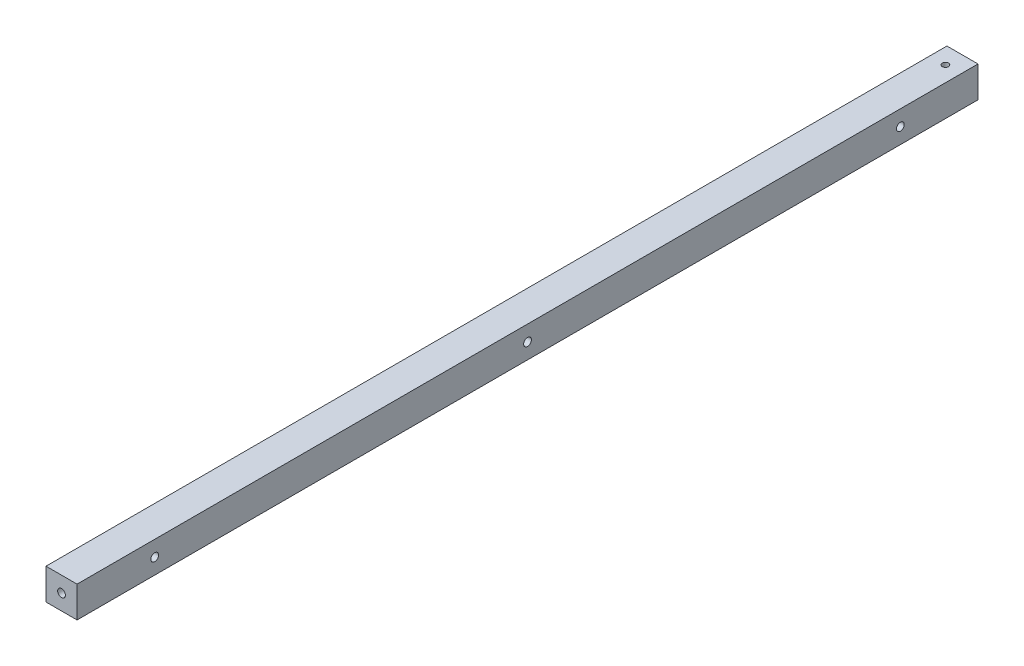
SolidWorks part; units mm, degrees
ref_plane "Plan de face" through (0, 0, 0) normal (0, 0, 1) x (1, 0, 0)
ref_plane "Plan de dessus" through (0, 0, 0) normal (0, 1, 0) x (1, 0, 0)
ref_plane "Plan de droite" through (0, 0, 0) normal (1, 0, 0) x (0, 0, -1)
sketch "Esquisse1" plane through (0, 0, 0) normal (0, 0, 1) x (1, 0, 0)
  line L1 (-10, 10) -> (10, 10)
  line L2 (-10, 10) -> (-10, -10)
  line L3 (-10, -10) -> (10, -10)
  line L4 (10, 10) -> (10, -10)
  dimension "D1" = 20
  dimension "D2" = 20
  dimension "D3" = 10
  dimension "D4" = 10
extrude "Extrusion1" add sketch "Esquisse1" along normal blind 580
hole_wizard "Diamètre du perçage M12.5 (12.500000)1" positions "Esquisse3" profile "Esquisse2" hole size "M12.5" standard "ISO"
sketch "Esquisse3" plane through (0, 0, 0) normal (0, 0, -1) x (-1, 0, 0)
  point P0 (0, 0)
sketch "Esquisse2" plane through (0, 0, 0) normal (1, 0, 0) x (0, 1, 0)
  line L0 (0, 0) -> (0, 23.7554)
  line L1 (0, 23.7554) -> (6.25, 20)
  line L2 (6.25, 20) -> (6.25, 0)
  line L5 (6.25, 0) -> (0, 0)
  line L10 (0, 23.7554) -> (-6.25, 20) construction
  line L11 (0, -6.35) -> (0, 107.95) construction
  dimension "Diamètre du perçage" = 12.5
  dimension "Profondeur du perçage" = 20
  dimension "Angle de pointe" = 118
hole_wizard "Diamètre du perçage M4.0 (4.000000)1" positions "Esquisse5" profile "Esquisse4" hole size "M4.0" standard "ISO"
sketch "Esquisse5" plane through (0, -10, 0) normal (0, -1, 0) x (1, 0, 0)
  line L0 (-10, 0) -> (10, 0) construction
  point P0 (0, 11)
  dimension "D1" = 11
sketch "Esquisse4" plane through (0, -10, 11) normal (1, 0, 0) x (0, 0, -1)
  line L0 (0, 0) -> (0, 20)
  line L1 (0, 20) -> (2, 20)
  line L2 (2, 20) -> (2, 0)
  line L5 (2, 0) -> (0, 0)
  line L11 (0, -6.35) -> (0, 107.95) construction
  dimension "Diamètre du perçage jusqu'au prochain" = 4
  dimension "Profondeur du perçage jusqu'au prochain" = 20
hole_wizard "Trou taraudé M6x1.01" positions "Esquisse7" profile "Esquisse6" tap size "M6x1.0" standard "ISO"
sketch "Esquisse7" plane through (10, 0, 0) normal (1, 0, 0) x (0, 0, -1)
  line L0 (0, -10) -> (0, 10) construction
  line L1 (-580, -10) -> (-580, 10) construction
  line L2 (-290, 10) -> (-290, -10) construction
  line L3 (-580, 10) -> (0, 10) construction
  line L5 (-580, -10) -> (0, -10) construction
  point P0 (-50, 0)
  point P1 (-290, 0)
  point P3 (-530, 0)
  dimension "D1" = 50
  dimension "D2" = 50
sketch "Esquisse6" plane through (10, 0, 50) normal (0, 1, 0) x (0, 0, -1)
  line L0 (0, 0) -> (0, 20)
  line L1 (0, 20) -> (2.5, 20)
  line L2 (2.5, 20) -> (2.5, 0)
  line L5 (2.5, 0) -> (0, 0)
  line L11 (0, -6.35) -> (0, 107.95) construction
  dimension "Diamètre du trou pour taraudage jusqu'au prochain" = 5
  dimension "Profondeur du trou pour taraudage jusqu'au prochain" = 20
hole_wizard "Trou taraudé M6x1.02" positions "Esquisse9" profile "Esquisse8" tap size "M6x1.0" standard "ISO"
sketch "Esquisse9" plane through (0, 0, 580) normal (0, 0, 1) x (1, 0, 0)
  point P0 (0, 0)
sketch "Esquisse8" plane through (0, 0, 580) normal (1, 0, 0) x (0, -1, 0)
  line L0 (0, 0) -> (0, 16.5022)
  line L1 (0, 16.5022) -> (2.5, 15)
  line L2 (2.5, 15) -> (2.5, 0)
  line L5 (2.5, 0) -> (0, 0)
  line L10 (0, 16.5022) -> (-2.5, 15) construction
  line L11 (0, -6.35) -> (0, 107.95) construction
  dimension "Diamètre du trou pour taraudage" = 5
  dimension "Profondeur du trou pour taraudage" = 15
  dimension "Angle de pointe" = 118
